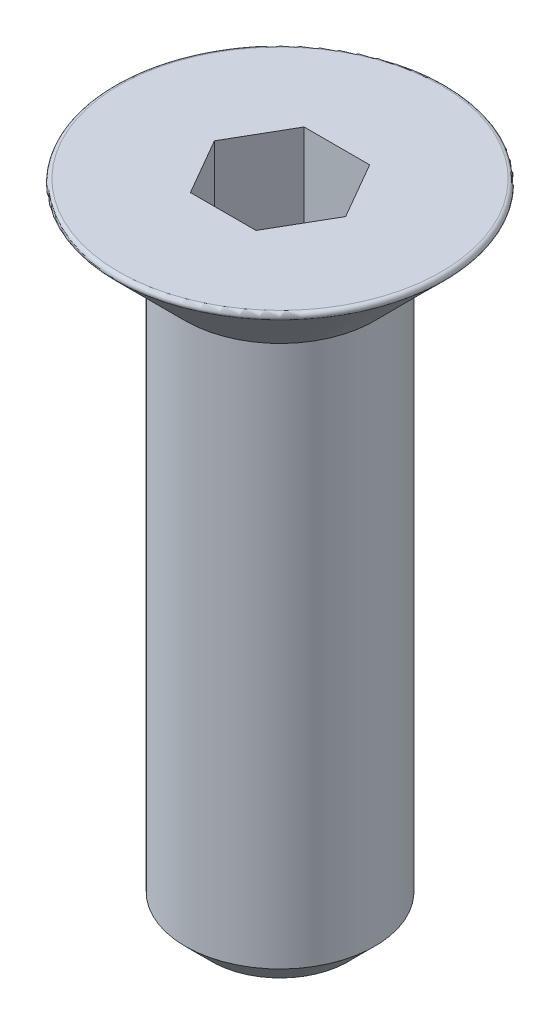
SolidWorks part; units mm, degrees
ref_plane "Plan de face" through (0, 0, 0) normal (0, 0, 1) x (1, 0, 0)
ref_plane "Plan de dessus" through (0, 0, 0) normal (0, 1, 0) x (1, 0, 0)
ref_plane "Plan de droite" through (0, 0, 0) normal (1, 0, 0) x (0, 0, -1)
sketch "Esquisse1" plane through (0, 0, 0) normal (0, 0, 1) x (1, 0, 0)
  line L0 (0, 15.488) -> (0, -29.9279) construction
  line L1 (0, 0) -> (-4.5, 0)
  line L2 (-4.5, 0) -> (-2.5, -2)
  line L3 (-2.5, -2) -> (-2.5, -17)
  line L4 (-2.5, -17) -> (0, -17)
  line L5 (0, 0) -> (0, -17)
  dimension "D1" = 4.5
  dimension "D2" = 2.5
  dimension "D3" = 45
  dimension "D4" = 15
revolve "Révolution1" add sketch "Esquisse1" angle 360 about L0
fillet "Congé1" radius 0.1 1 edges at (0, 0, 4.5)
chamfer "Chanfrein1" distance 0.7 angle 45 1 edges at (0, -17, 2.5)
sketch "Esquisse2" plane through (0, 0, 0) normal (0, 1, 0) x (1, 0, 0)
  line L1 (1.7321, 0) -> (0.866, 1.5)
  line L2 (0.866, 1.5) -> (-0.866, 1.5)
  line L3 (-0.866, 1.5) -> (-1.7321, 0)
  line L4 (-1.7321, 0) -> (-0.866, -1.5)
  line L5 (-0.866, -1.5) -> (0.866, -1.5)
  line L6 (0.866, -1.5) -> (1.7321, 0)
  circle A0 centre (0, 0) radius 1.5 construction
  dimension "D1" = 3
extrude "Enlèv. mat.-Extru.1" cut sketch "Esquisse2" against normal blind 3
